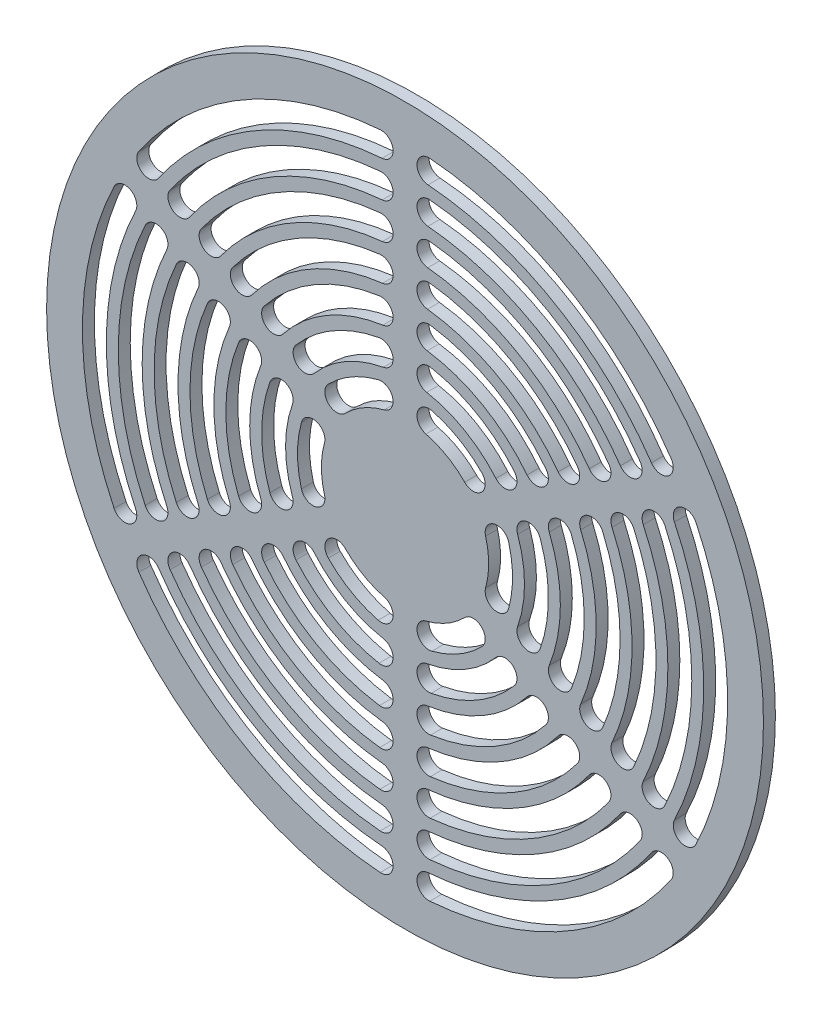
SolidWorks part; units mm, degrees
ref_plane "Front" through (0, 0, 0) normal (0, 0, 1) x (1, 0, 0)
ref_plane "Top" through (0, 0, 0) normal (0, 1, 0) x (1, 0, 0)
ref_plane "Right" through (0, 0, 0) normal (1, 0, 0) x (0, 0, -1)
sketch "Sketch1" plane through (0, 0, 0) normal (0, 0, 1) x (1, 0, 0)
  circle A0 centre (0, 0) radius 190.5
  dimension "D1" = 381
extrude "Extrude1" add sketch "Sketch1" along normal blind 6.35
sketch "Sketch2" plane through (0, 0, 6.35) normal (0, 0, 1) x (1, 0, 0)
  line L0 (0, 0) -> (190.5, 0) construction
  line L1 (0, 0) -> (0, 190.5) construction
  line L2 (0, 0) -> (164.9778, 95.25) construction
  line L3 (6.35, 10.9985) -> (161.8028, 100.7493) construction
  line L4 (6.35, 10.9985) -> (6.35, 190.5) construction
  line L5 (12.7, 49.1869) -> (36.2471, 35.592) construction
  line L6 (24.4735, 42.3894) -> (25.4, 43.9941) construction
  circle A0 centre (0, 0) radius 190.5 construction
  arc A1 (12.7, 49.1869) -> (36.2471, 35.592) centre (0, 0) cw construction
  arc A2 (11.1125, 43.0385) -> (31.7162, 31.143) centre (0, 0) cw
  arc A3 (14.2875, 55.3352) -> (40.778, 40.041) centre (0, 0) cw
  arc A4 (31.7162, 31.143) -> (40.778, 40.041) centre (36.2471, 35.592) ccw
  arc A5 (11.1125, 43.0385) -> (14.2875, 55.3352) centre (12.7, 49.1869) cw
  dimension "D4" = 6.35
  dimension "D1" = 30
  dimension "D3" = 50.8
  dimension "D2" = 6.35
extrude "Cut-Extrude1" cut sketch "Sketch2" against normal through all
pattern_linear "LPattern1" count 7 spacing 19.05 of "Cut-Extrude1"
pattern_circular "CirPattern1" count 6 over 360 about axis through (0, 0, 0) along (0, 0, 1) of "LPattern1", "Cut-Extrude1"
